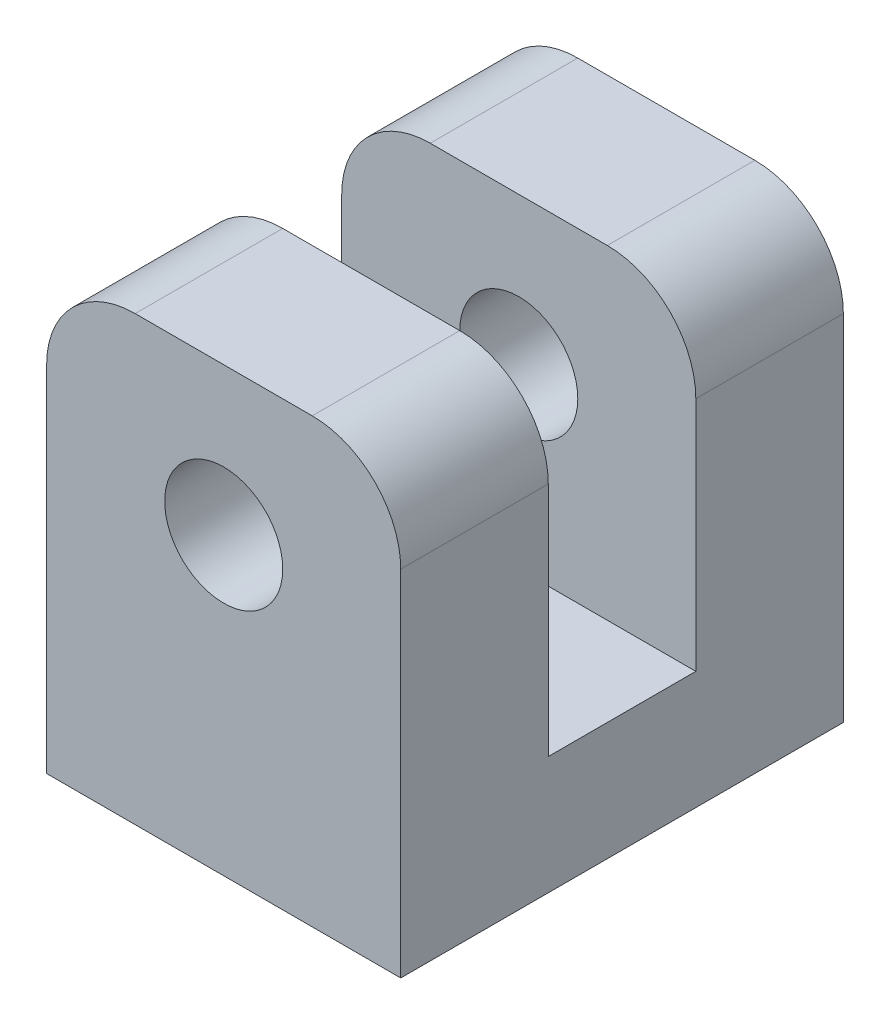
SolidWorks part; units mm, degrees
ref_plane "正面" through (0, 0, 0) normal (0, 0, 1) x (1, 0, 0)
ref_plane "平面" through (0, 0, 0) normal (0, 1, 0) x (1, 0, 0)
ref_plane "右側面" through (0, 0, 0) normal (1, 0, 0) x (0, 0, -1)
sketch "ｽｹｯﾁ1" plane through (0, 0, 0) normal (0, 0, 1) x (1, 0, 0)
  line L1 (0, 0) -> (120, 0)
  line L2 (0, 0) -> (0, 150)
  line L3 (0, 150) -> (120, 150)
  line L4 (120, 0) -> (120, 150)
  dimension "D1" = 120
  dimension "D2" = 150
extrude "押し出し1" add sketch "ｽｹｯﾁ1" along normal blind 150
sketch "ｽｹｯﾁ2" plane through (0, 150, 0) normal (0, 1, 0) x (1, 0, 0)
  line L0 (0, -150) -> (0, 0) construction
  line L1 (0, -50) -> (120, -50)
  line L2 (0, -50) -> (0, -100)
  line L3 (0, -100) -> (120, -100)
  line L4 (120, -50) -> (120, -100)
  line L5 (120, -150) -> (120, 0) construction
  line L6 (120, -150) -> (0, -150) construction
  line L7 (120, 0) -> (0, 0) construction
  dimension "D1" = 50
  dimension "D2" = 50
extrude "押し出し2" cut sketch "ｽｹｯﾁ2" against normal blind 110
sketch "ｽｹｯﾁ3" plane through (0, 0, 150) normal (0, 0, 1) x (1, 0, 0)
  line L0 (120, 0) -> (120, 150) construction
  line L3 (0, 0) -> (120, 0) construction
  circle A0 centre (60, 100) radius 20
  dimension "D1" = 40
  dimension "D2" = 60
  dimension "D3" = 100
extrude "押し出し3" cut sketch "ｽｹｯﾁ3" against normal through all
sketch "ｽｹｯﾁ4" plane through (0, 0, 0) normal (0, -1, 0) x (1, 0, 0)
  line L0 (0, 0) -> (120, 0) construction
  line L3 (120, 150) -> (120, 0) construction
  circle A0 centre (60, 75) radius 30
  dimension "D1" = 60
  dimension "D2" = 75
  dimension "D3" = 60
extrude "押し出し4" cut sketch "ｽｹｯﾁ4" against normal blind 35
fillet "ﾌｨﾚｯﾄ1" radius 30 4 edges at (120, 150, 25) (120, 150, 125) (0, 150, 125) (0, 150, 25)
